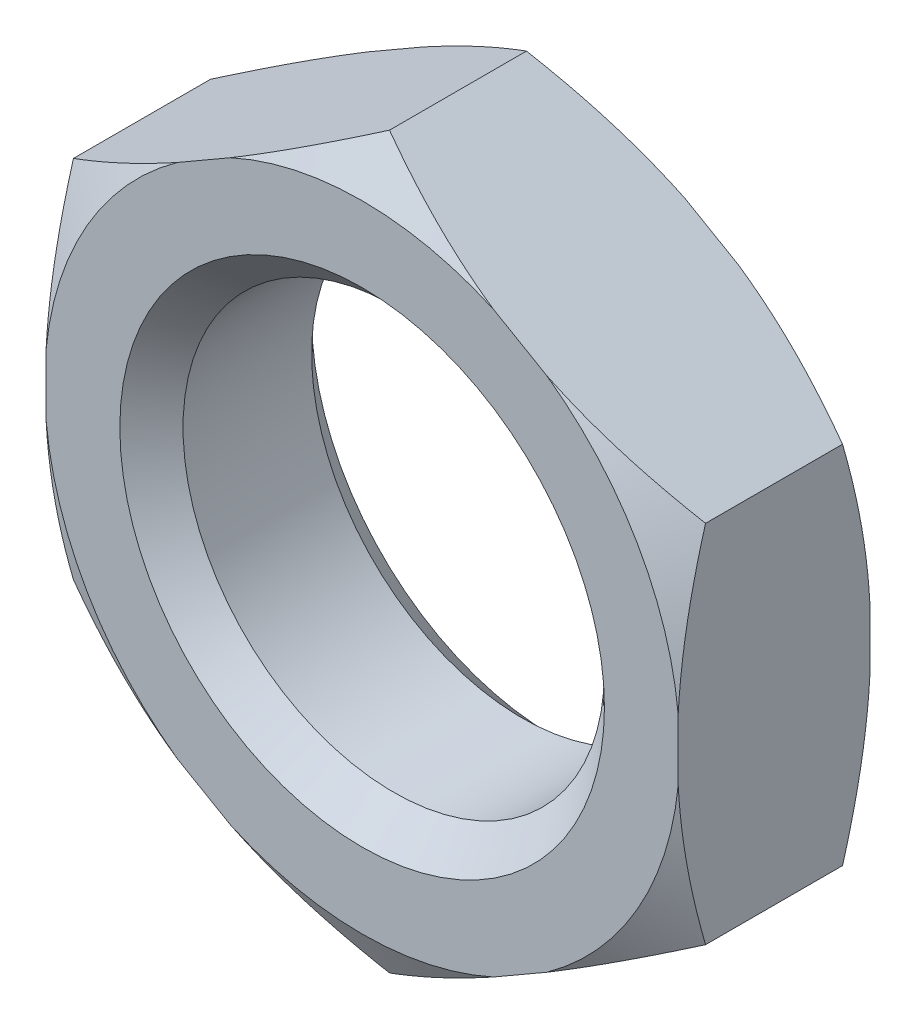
SolidWorks part; units mm, degrees
ref_plane "Front Plane" through (0, 0, 0) normal (0, 0, 1) x (1, 0, 0)
ref_plane "Top Plane" through (0, 0, 0) normal (0, 1, 0) x (1, 0, 0)
ref_plane "Right Plane" through (0, 0, 0) normal (1, 0, 0) x (0, 0, -1)
sketch "Sketch3" plane through (0, 0, 0) normal (0, 0, 1) x (1, 0, 0)
  line L1 (0, 17.3205) -> (-15, 8.6603)
  line L2 (-15, 8.6603) -> (-15, -8.6603)
  line L3 (-15, -8.6603) -> (0, -17.3205)
  line L4 (0, -17.3205) -> (15, -8.6603)
  line L5 (15, -8.6603) -> (15, 8.6603)
  line L6 (15, 8.6603) -> (0, 17.3205)
  circle A0 centre (0, 0) radius 15 construction
  dimension "D1" = 30
extrude "Boss-Extrude1" add sketch "Sketch3" along normal mid plane 9.1
sketch "Sketch4" plane through (0, 0, 0) normal (1, 0, 0) x (0, 0, -1)
  line L0 (-5.4578, 0) -> (6.1545, 0) construction
sketch "Sketch5" plane through (0, 0, 0) normal (1, 0, 0) x (0, 0, -1)
  line L0 (-4.55, 17.3205) -> (-4.55, 15.0705)
  line L1 (-4.55, 8.6603) -> (-4.55, 17.3205) construction
  line L2 (-4.55, 15.0705) -> (-3.251, 17.3205)
  line L3 (-4.55, 17.3205) -> (4.55, 17.3205) construction
  line L4 (-3.251, 17.3205) -> (-4.55, 17.3205)
  dimension "D1" = 2.25
  dimension "D2" = 30
revolve "Cut-Revolve1" cut sketch "Sketch5" angle 360 about L0
mirror "Mirror1" about plane through (0, 0, 0) normal (0, 0, 1) of "Cut-Revolve1"
sketch "Sketch6" plane through (0, 0, 4.55) normal (0, 0, 1) x (1, 0, 0)
  circle A0 centre (0, 0) radius 10
  dimension "D1" = 20
extrude "Cut-Extrude1" cut sketch "Sketch6" against normal blind 9.1
chamfer "Chamfer1" distance 1.5 angle 45 2 edges at (10, 0, -4.55) (10, 0, 4.55)
